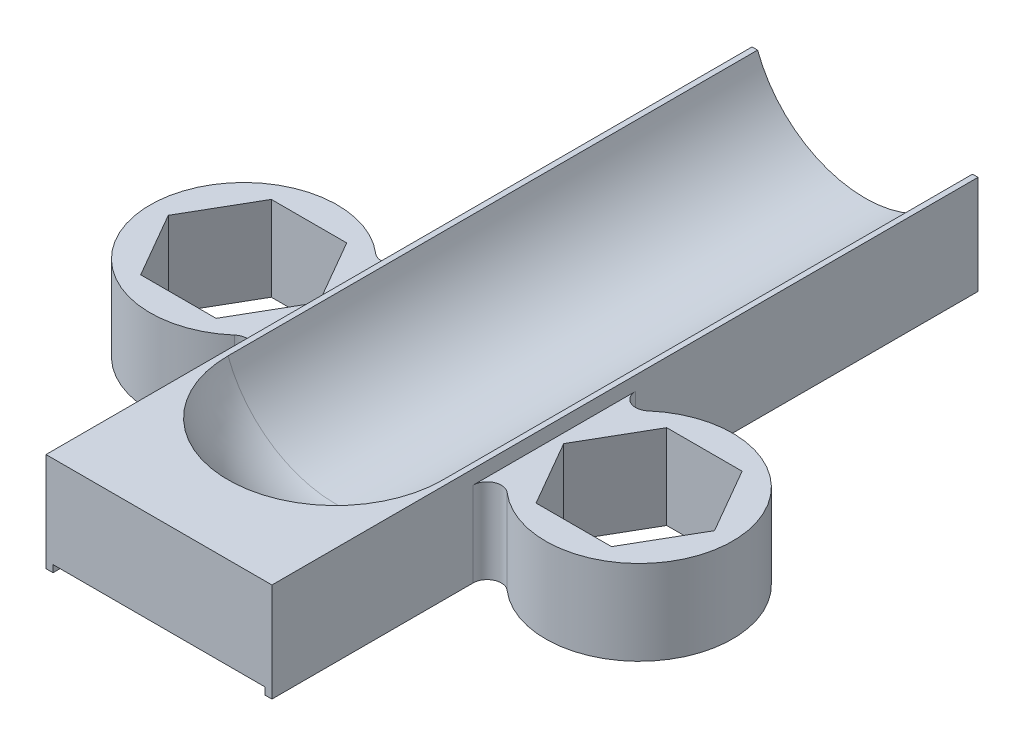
SolidWorks part; units mm, degrees
ref_plane "Front Plane" through (0, 0, 0) normal (0, 0, 1) x (1, 0, 0)
ref_plane "Top Plane" through (0, 0, 0) normal (0, 1, 0) x (1, 0, 0)
ref_plane "Right Plane" through (0, 0, 0) normal (1, 0, 0) x (0, 0, -1)
sketch "Sketch1" plane through (0, 0, 0) normal (0, 1, 0) x (1, 0, 0)
  line L0 (0, 0) -> (0, 139.7) construction
  line L1 (-53.975, 0) -> (53.975, 0)
  line L2 (-53.975, 0) -> (-53.975, 139.7)
  line L3 (-53.975, 139.7) -> (53.975, 139.7)
  line L4 (53.975, 0) -> (53.975, 139.7)
  line L5 (-53.975, 44.45) -> (53.975, 44.45) construction
  line L6 (-35.56, 63.5) -> (35.56, 63.5) construction
  line L7 (-42.3424, 51.7525) -> (-49.1248, 63.5)
  line L8 (42.3424, 75.2475) -> (28.7776, 75.2475)
  line L9 (28.7776, 75.2475) -> (21.9952, 63.5)
  line L10 (21.9952, 63.5) -> (28.7776, 51.7525)
  line L11 (28.7776, 51.7525) -> (42.3424, 51.7525)
  line L12 (42.3424, 51.7525) -> (49.1248, 63.5)
  line L13 (49.1248, 63.5) -> (42.3424, 75.2475)
  line L14 (-49.1248, 63.5) -> (-42.3424, 75.2475)
  line L15 (-42.3424, 75.2475) -> (-28.7776, 75.2475)
  line L16 (-28.7776, 75.2475) -> (-21.9952, 63.5)
  line L17 (-21.9952, 63.5) -> (-28.7776, 51.7525)
  line L18 (-28.7776, 51.7525) -> (-42.3424, 51.7525)
  circle A0 centre (-35.56, 63.5) radius 7.366 construction
  circle A1 centre (-35.56, 63.5) radius 15.875 construction
  circle A2 centre (35.56, 63.5) radius 15.875 construction
  circle A3 centre (35.56, 63.5) radius 9.779 construction
  circle A4 centre (-35.56, 63.5) radius 9.779 construction
  circle A5 centre (35.56, 63.5) radius 7.366 construction
  circle A6 centre (-35.56, 63.5) radius 10.16 construction
  circle A7 centre (35.56, 63.5) radius 11.7475 construction
  circle A8 centre (35.56, 63.5) radius 11.7475 construction
  point P4 (0, 0)
  point P15 (0, 63.5)
  dimension "D4" = 14.732
  dimension "D7" = 31.75
  dimension "D8" = 19.558
  dimension "D9" = 20.32
  dimension "D10" = 23.495
  dimension "D1" = 139.7
  dimension "D2" = 107.95
  dimension "D3" = 44.45
  dimension "D5" = 35.56
  dimension "D6" = 76.2
extrude "Boss-Extrude1" add sketch "Sketch1" along normal blind 2.54
sketch "Sketch2" plane through (0, 2.54, 0) normal (0, 1, 0) x (1, 0, 0)
  line L0 (53.975, 139.7) -> (-53.975, 139.7) construction
  line L1 (-20.32, 139.7) -> (20.32, 139.7)
  line L2 (-20.32, 139.7) -> (-20.32, 0)
  line L3 (-20.32, 0) -> (20.32, 0)
  line L4 (20.32, 139.7) -> (20.32, 0)
  line L5 (-53.975, 0) -> (53.975, 0) construction
  line L6 (-20.32, 44.45) -> (20.32, 44.45)
  point P8 (0, 0)
  dimension "D1" = 40.64
  dimension "D2" = 44.45
extrude "Boss-Extrude2" add sketch "Sketch2" along normal blind 15.24 contours L2 L6 L4 M5
sketch "Sketch3" plane through (0, 0, -139.7) normal (0, 0, 1) x (1, 0, 0)
  line L0 (-18.415, 2.54) -> (18.415, 2.54)
  line L1 (0, 2.54) -> (0, 25.019) construction
  line L2 (-20.32, 2.54) -> (-53.975, 2.54) construction
  circle A1 centre (0, 25.019) radius 20.6375
  point P2 (0, 4.3815)
  dimension "D1" = 1.8415
  dimension "D2" = 41.275
extrude "Cut-Extrude1" cut sketch "Sketch3" along normal through all
sketch "Sketch8" plane through (0, 2.54, 0) normal (0, 1, 0) x (1, 0, 0)
  line L0 (20.32, 139.7) -> (20.32, 44.45) construction
  line L1 (-20.32, 44.45) -> (20.32, 44.45)
  line L2 (-20.32, 44.45) -> (-20.32, 12.7)
  line L3 (-20.32, 12.7) -> (20.32, 12.7)
  line L4 (20.32, 44.45) -> (20.32, 12.7)
  dimension "D1" = 31.75
extrude "Boss-Extrude5" add sketch "Sketch8" along normal up to surface (15.24 mm away)
sketch "Sketch9" plane through (0, 0, -44.45) normal (0, 0, -1) x (-1, 0, 0)
  line L0 (0, 4.3815) -> (0, 17.78)
  line L1 (-19.3262, 17.78) -> (19.3262, 17.78) construction
  line L2 (0, 17.78) -> (19.3262, 17.78)
  arc A0 (-19.3262, 17.78) -> (19.3262, 17.78) centre (0, 25.019) ccw construction
  arc A1 (0, 4.3815) -> (19.3262, 17.78) centre (0, 25.019) ccw
revolve "Cut-Revolve1" cut sketch "Sketch9" angle 360 about L0
sketch "Sketch4" plane through (0, 2.54, 0) normal (0, 1, 0) x (1, 0, 0)
  line L0 (0, 0) -> (0, 139.7)
  line L1 (21.9952, 63.5) -> (28.7776, 51.7525) construction
  line L2 (49.1248, 63.5) -> (42.3424, 75.2475) construction
  line L3 (42.3424, 51.7525) -> (49.1248, 63.5) construction
  line L4 (19.3262, 139.7) -> (-19.3262, 139.7) construction
  line L6 (-49.1248, 63.5) -> (-42.3424, 51.7525) construction
  line L7 (-21.9952, 63.5) -> (-28.7776, 75.2475) construction
  line L9 (20.32, 139.7) -> (20.32, 0)
  line L10 (-53.975, 0) -> (53.975, 0) construction
  line L12 (-20.32, 139.7) -> (-20.32, 0)
  circle A0 centre (-35.56, 63.5) radius 11.7475
  circle A1 centre (35.56, 63.5) radius 11.7475
  arc A2 (20.32, 56.3651) -> (20.32, 70.6349) centre (35.56, 63.5) ccw
  arc A3 (-20.32, 70.6349) -> (-20.32, 56.3651) centre (-35.56, 63.5) ccw
  circle A5 centre (-35.56, 63.5) radius 16.8275 construction
  circle A6 centre (35.56, 63.5) radius 16.8275 construction
  point P18 (48.26, 63.5)
  point P28 (-17.78, 63.5)
  dimension "D6" = 5.08
extrude "Cut-Extrude2" cut sketch "Sketch4" against normal blind 2.54
fillet "Fillet1" radius 2.54 4 edges at (-20.32, 1.27, -70.6349) (-20.32, 1.27, -56.3651) (20.32, 1.27, -56.3651) (20.32, 1.27, -70.6349)
sketch "Sketch6" plane through (0, 2.54, 0) normal (0, 1, 0) x (1, 0, 0)
  line L0 (-28.7776, 51.7525) -> (-21.9952, 63.5) construction
  line L1 (-20.32, 48.8778) -> (-20.32, 78.1222)
  line L2 (-20.32, 48.8778) -> (-20.32, 78.1222)
  line L3 (-42.3424, 51.7525) -> (-28.7776, 51.7525) construction
  line L4 (-49.1248, 63.5) -> (-42.3424, 51.7525) construction
  line L5 (-42.3424, 75.2475) -> (-49.1248, 63.5) construction
  line L6 (-28.7776, 75.2475) -> (-42.3424, 75.2475) construction
  line L7 (-21.9952, 63.5) -> (-28.7776, 75.2475) construction
  line L8 (-28.7776, 51.7525) -> (-21.9952, 63.5)
  line L9 (-42.3424, 51.7525) -> (-28.7776, 51.7525)
  line L10 (-49.1248, 63.5) -> (-42.3424, 51.7525)
  line L11 (-42.3424, 75.2475) -> (-49.1248, 63.5)
  line L12 (-28.7776, 75.2475) -> (-42.3424, 75.2475)
  line L13 (-21.9952, 63.5) -> (-28.7776, 75.2475)
  line L14 (42.3424, 51.7525) -> (49.1248, 63.5) construction
  line L15 (20.32, 78.1222) -> (20.32, 48.8778)
  line L16 (20.32, 78.1222) -> (20.32, 48.8778)
  line L17 (49.1248, 63.5) -> (42.3424, 75.2475) construction
  line L18 (42.3424, 75.2475) -> (28.7776, 75.2475) construction
  line L19 (28.7776, 75.2475) -> (21.9952, 63.5) construction
  line L20 (21.9952, 63.5) -> (28.7776, 51.7525) construction
  line L21 (28.7776, 51.7525) -> (42.3424, 51.7525) construction
  line L22 (42.3424, 51.7525) -> (49.1248, 63.5)
  line L23 (49.1248, 63.5) -> (42.3424, 75.2475)
  line L24 (42.3424, 75.2475) -> (28.7776, 75.2475)
  line L25 (28.7776, 75.2475) -> (21.9952, 63.5)
  line L26 (21.9952, 63.5) -> (28.7776, 51.7525)
  line L27 (28.7776, 51.7525) -> (42.3424, 51.7525)
  arc A3 (-24.5256, 76.2046) -> (-20.32, 78.1222) centre (-22.86, 78.1222) ccw
  arc A4 (-24.5256, 76.2046) -> (-24.5256, 50.7954) centre (-35.56, 63.5) ccw
  arc A5 (-24.5256, 76.2046) -> (-20.32, 78.1222) centre (-22.86, 78.1222) ccw
  arc A6 (-20.32, 48.8778) -> (-24.5256, 50.7954) centre (-22.86, 48.8778) ccw
  arc A7 (-24.5256, 76.2046) -> (-24.5256, 50.7954) centre (-35.56, 63.5) ccw
  arc A8 (-20.32, 48.8778) -> (-24.5256, 50.7954) centre (-22.86, 48.8778) ccw
  arc A9 (24.5256, 50.7954) -> (20.32, 48.8778) centre (22.86, 48.8778) ccw
  arc A10 (24.5256, 50.7954) -> (20.32, 48.8778) centre (22.86, 48.8778) ccw
  arc A11 (24.5256, 50.7954) -> (24.5256, 76.2046) centre (35.56, 63.5) ccw
  arc A12 (24.5256, 50.7954) -> (24.5256, 76.2046) centre (35.56, 63.5) ccw
  arc A13 (20.32, 78.1222) -> (24.5256, 76.2046) centre (22.86, 78.1222) ccw
  arc A14 (20.32, 78.1222) -> (24.5256, 76.2046) centre (22.86, 78.1222) ccw
  dimension "D1" = 0
  dimension "D2" = 0
extrude "Boss-Extrude4" add sketch "Sketch6" along normal offset from surface (12.7 mm away) 2.54
shell "Shell1" thickness 1.27
sketch "Sketch5" plane through (0, 0, 0) normal (0, -1, 0) x (1, 0, 0)
  line L0 (28.0443, -76.5175) -> (20.5287, -63.5) construction
  line L1 (24.9281, -71.12) -> (-24.9281, -71.12)
  line L3 (24.1949, -69.85) -> (-24.1949, -69.85)
  line L5 (20.5287, -63.5) -> (28.0443, -50.4825) construction
  line L6 (24.9281, -71.12) -> (24.1949, -69.85)
  line L7 (24.1949, -57.15) -> (-24.1949, -57.15)
  line L8 (-20.5287, -63.5) -> (-28.0443, -76.5175) construction
  line L9 (24.9281, -55.88) -> (-24.9281, -55.88)
  line L10 (-28.0443, -50.4825) -> (-20.5287, -63.5) construction
  line L13 (24.1949, -57.15) -> (24.9281, -55.88)
  line L14 (-24.1949, -69.85) -> (-24.9281, -71.12)
  line L15 (-24.9281, -55.88) -> (-24.1949, -57.15)
  point P14 (21.9952, -63.5)
  dimension "D1" = 1.27
  dimension "D2" = 1.27
  dimension "D3" = 6.35
  dimension "D4" = 6.35
extrude "Boss-Extrude3" add sketch "Sketch5" against normal up to body
sketch "Sketch10" plane through (0, 2.54, 0) normal (0, 1, 0) x (1, 0, 0)
  line L1 (20.32, 12.7) -> (-20.32, 12.7)
  line L2 (20.32, 12.7) -> (20.32, 0)
  line L3 (20.32, 0) -> (-20.32, 0)
  line L4 (-20.32, 12.7) -> (-20.32, 0)
extrude "Cut-Extrude3" cut sketch "Sketch10" against normal through all
